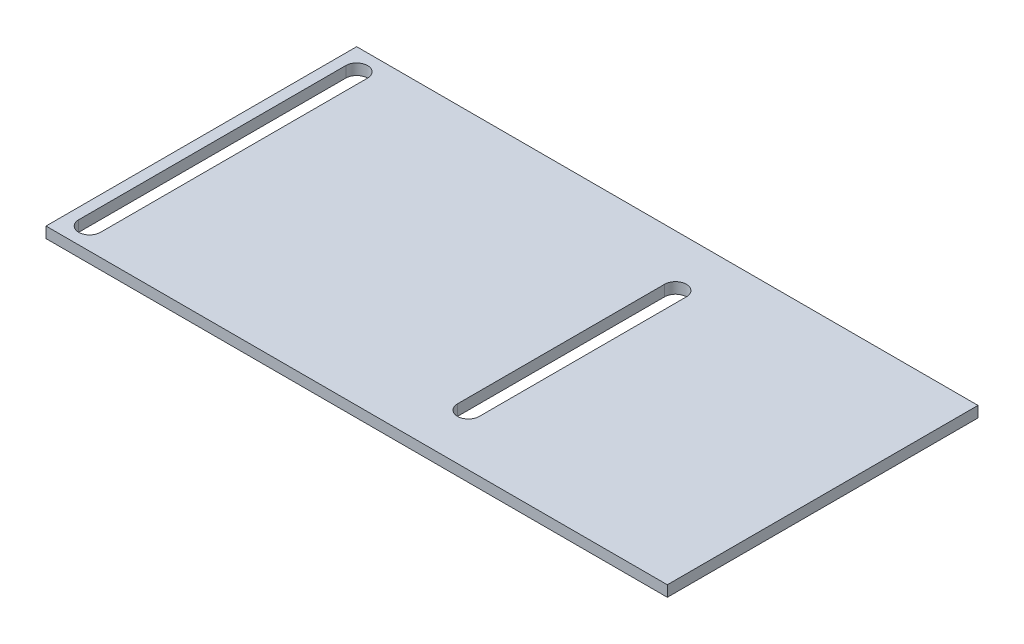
SolidWorks part; units mm, degrees
ref_plane "Front Plane" through (0, 0, 0) normal (0, 0, 1) x (1, 0, 0)
ref_plane "Top Plane" through (0, 0, 0) normal (0, 1, 0) x (1, 0, 0)
ref_plane "Right Plane" through (0, 0, 0) normal (1, 0, 0) x (0, 0, -1)
sketch "Sketch1" plane through (0, 0, 0) normal (0, 1, 0) x (1, 0, 0)
  line L1 (-57, -28.5) -> (57, -28.5)
  line L2 (-57, -28.5) -> (-57, 28.5)
  line L3 (-57, 28.5) -> (57, 28.5)
  line L4 (57, -28.5) -> (57, 28.5)
  line L5 (-57, -28.5) -> (57, 28.5) construction
  line L6 (-57, 28.5) -> (57, -28.5) construction
  point P0 (0, 0)
  point P8 (0, 0)
  dimension "D1" = 57
  dimension "D2" = 114
extrude "Boss-Extrude1" add sketch "Sketch1" along normal blind 2
sketch "Sketch2" plane through (0, 2, 0) normal (0, 1, 0) x (1, 0, 0)
  line L0 (-53, -24.5) -> (-53, 24.5) construction
  line L1 (-55, -24.5) -> (-55, 24.5)
  line L2 (-51, -24.5) -> (-51, 24.5)
  line L3 (-57, 28.5) -> (-57, -28.5) construction
  line L4 (-57, -28.5) -> (57, -28.5) construction
  line L6 (57, 28.5) -> (-57, 28.5) construction
  arc A0 (-55, -24.5) -> (-51, -24.5) centre (-53, -24.5) ccw
  arc A1 (-51, 24.5) -> (-55, 24.5) centre (-53, 24.5) ccw
  point P2 (-53, 0)
  dimension "D3" = 4
  dimension "D1" = 2
  dimension "D2" = 4
  dimension "D4" = 4
extrude "Cut-Extrude1" cut sketch "Sketch2" against normal blind 2
sketch "Sketch3" plane through (0, 2, 0) normal (0, 1, 0) x (1, 0, 0)
  line L0 (11, 19) -> (11, -19) construction
  line L1 (13, 19) -> (13, -19)
  line L2 (9, 19) -> (9, -19)
  line L3 (-57, 28.5) -> (-57, -28.5) construction
  line L4 (0, 0) -> (11, 0) construction
  arc A0 (13, 19) -> (9, 19) centre (11, 19) ccw
  arc A1 (9, -19) -> (13, -19) centre (11, -19) ccw
  point P2 (11, 0)
  dimension "D3" = 38
  dimension "D1" = 66
  dimension "D2" = 4
extrude "Cut-Extrude2" cut sketch "Sketch3" against normal blind 2
